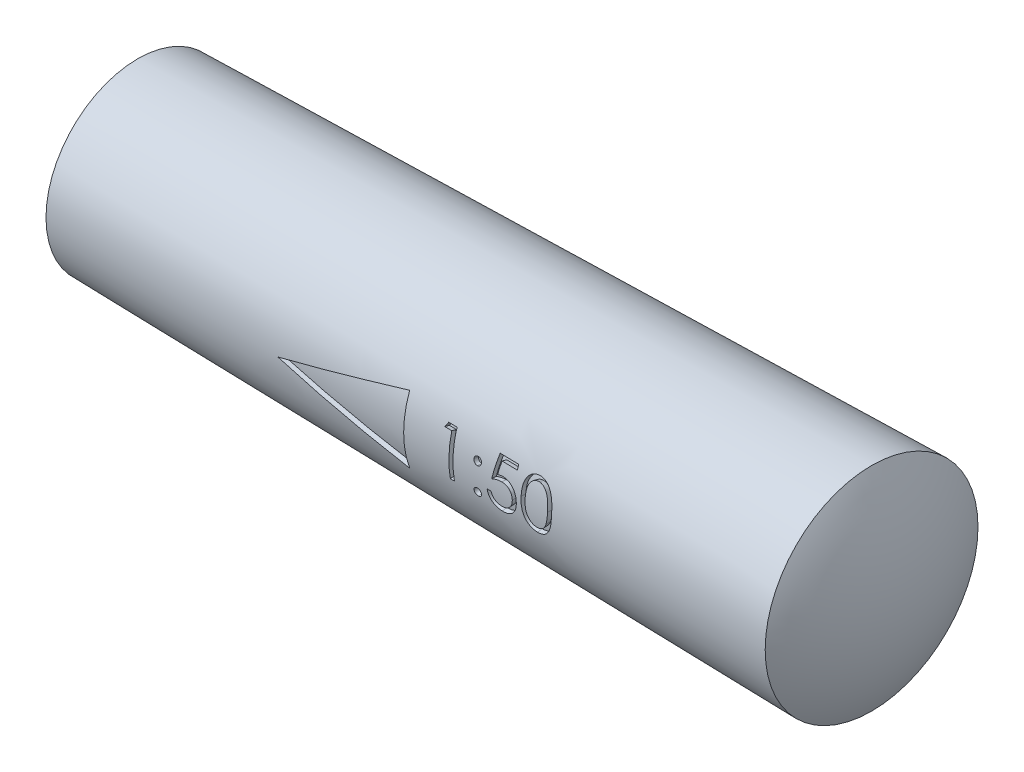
SolidWorks part; units mm, degrees
ref_plane "Front Plane" through (0, 0, 0) normal (0, 0, 1) x (1, 0, 0)
ref_plane "Top Plane" through (0, 0, 0) normal (0, 1, 0) x (1, 0, 0)
ref_plane "Right Plane" through (0, 0, 0) normal (1, 0, 0) x (0, 0, -1)
sketch "Sketch1" plane through (0, 0, 0) normal (1, 0, 0) x (0, 0, -1)
  circle A0 centre (0, 0) radius 2
  dimension "D1" = 4
extrude "Extrude1" add sketch "Sketch1" along normal mid plane 16
draft "Draft1" type of draft neutral plane draft angle 1.146 faces to draft 1 parameters "D1"=1.146
sketch "Sketch2" plane through (0, 0, 0) normal (0, 0, 1) x (1, 0, 0)
  line L0 (-8, 0) -> (-8, 2)
  line L1 (-8, 2) -> (-8, -2) construction
  line L2 (-8, 0) -> (-8.6, 0)
  line L3 (-8.6, 0) -> (-8.6, -2.16) construction
  line L4 (8, 0) -> (8, 2.32)
  line L5 (8, -2.32) -> (8, 2.32) construction
  line L6 (8, 0) -> (8.6, 0)
  line L7 (8.6, 0) -> (8.6, -2.16) construction
  line L8 (-8, -2) -> (8, -2.32) construction
  arc A0 (-8.6, 0) -> (-8, 2) centre (-4.9667, 0) cw
  arc A1 (8.6, 0) -> (8, 2.32) centre (3.8146, 0) ccw
  point P14 (0, -2.16)
revolve "Revolve1" add sketch "Sketch2" angle 360 about L2
sketch "Sketch5" plane through (0, 0, 0) normal (0, 0, 1) x (1, 0, 0)
  line L0 (0, 2.16) -> (0, -2.16) construction
  line L1 (8, 2.32) -> (-8, 2) construction
  line L2 (-8, -2) -> (8, -2.32) construction
ref_plane "Plane2" through (0, 0, 0) normal (-0.02, 0, 0.9998) x (0.9998, 0, 0.02)
sketch "Sketch6" plane through (0, 0, 0) normal (-0.02, 0, 0.9998) x (0.9998, 0, 0.02)
  line L0 (0, 0) -> (0, 0.75)
  line L1 (0, 2.16) -> (0, -2.16) construction
  line L2 (0, 0.75) -> (-2.799, 0)
  line L3 (-2.799, 0) -> (0, -0.75)
  line L4 (0, -0.75) -> (0, 0)
  line L5 (0, -0.375) -> (4, -0.375) construction
  text T0 "1:50" font "Century Gothic" height 1
  dimension "D1" = 1.5
  dimension "D2" = 30
  dimension "D3" = 4
wrap "Wrap2" sketch "Sketch6" wrap type deboss source sketch "Sketch6" thickness 0.1 parameters "D1"=0.1
equation "\"D2@Sketch2\" = \"D1@Sketch2\""
